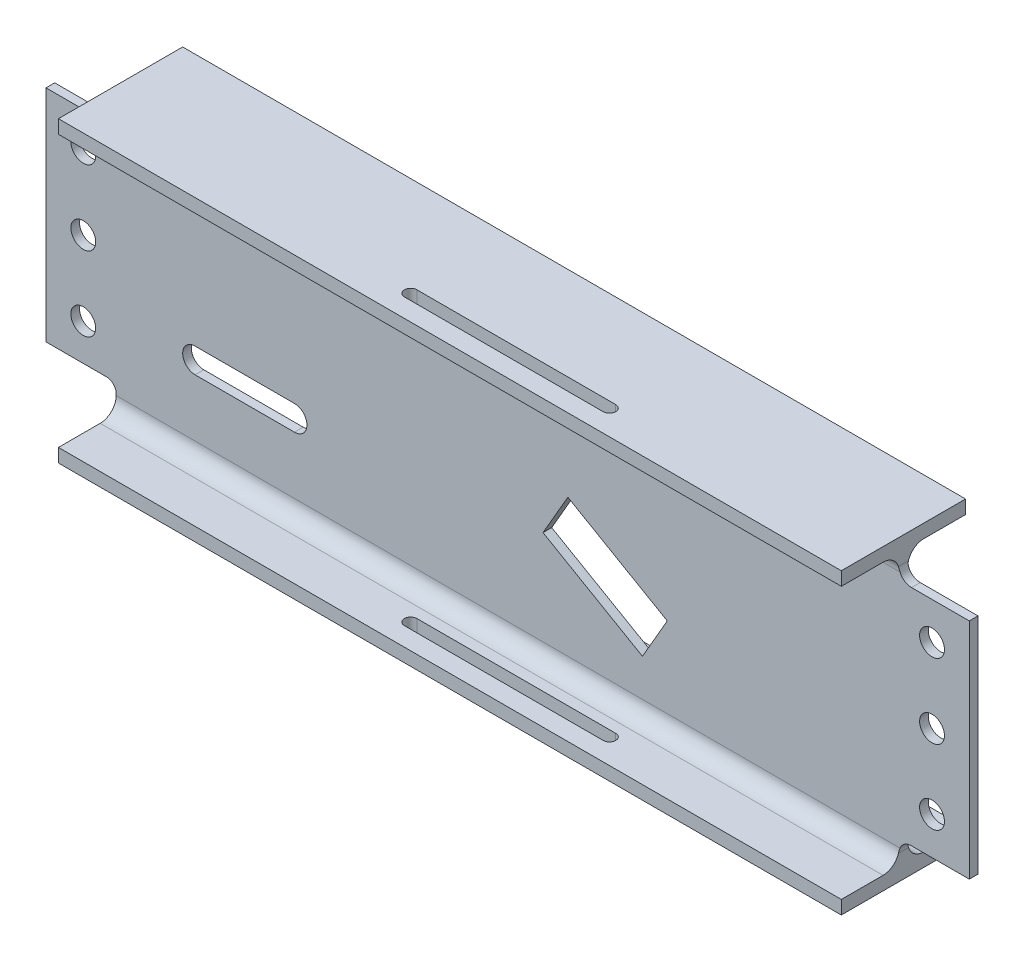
SolidWorks part; units mm, degrees
ref_plane "Front Plane" through (0, 0, 0) normal (0, 0, 1) x (1, 0, 0)
ref_plane "Top Plane" through (0, 0, 0) normal (0, 1, 0) x (1, 0, 0)
ref_plane "Right Plane" through (0, 0, 0) normal (1, 0, 0) x (0, 0, -1)
sketch "Member Sketch" plane through (0, 0, 0) normal (0, 1, 0) x (1, 0, 0)
  line L0 (0, 0) -> (1000, 0)
  line L2 (0, 0) -> (1000, 0) construction
other "Structural Member1"
ref_plane "Plane1" through (0, 0, 0) normal (1, 0, 0) x (0, 0, -1)
sketch "Sketch1" plane through (0, -152.4, 0) normal (1, 0, 0) x (0, 0, -1)
  line L0 (-63.5, 152.4) -> (63.5, 152.4)
  line L1 (63.5, 152.4) -> (63.5, 138.5824)
  line L2 (63.5, 138.5824) -> (20.8534, 138.5824)
  line L3 (4.445, 122.174) -> (4.445, -122.174)
  line L4 (-4.445, 0) -> (4.445, 0) construction
  line L5 (0, -152.4) -> (0, 152.4) construction
  line L6 (-4.445, 122.174) -> (-4.445, -122.174)
  line L7 (-63.5, 138.5824) -> (-20.8534, 138.5824)
  line L8 (-63.5, 152.4) -> (-63.5, 138.5824)
  line L9 (-63.5, -152.4) -> (-63.5, -138.5824)
  line L10 (-63.5, -138.5824) -> (-20.8534, -138.5824)
  line L11 (63.5, -138.5824) -> (20.8534, -138.5824)
  line L12 (63.5, -152.4) -> (63.5, -138.5824)
  line L13 (-63.5, -152.4) -> (63.5, -152.4)
  line L14 (-63.5, 138.5824) -> (-63.5, -138.5824) construction
  line L15 (63.5, 138.5824) -> (63.5, -138.5824) construction
  line L16 (-4.445, 0) -> (-63.5, 0) construction
  line L17 (4.445, 0) -> (63.5, 0) construction
  arc A0 (20.8534, 138.5824) -> (4.445, 122.174) centre (20.8534, 122.174) ccw
  arc A3 (-20.8534, 138.5824) -> (-4.445, 122.174) centre (-20.8534, 122.174) cw
  arc A4 (-20.8534, -138.5824) -> (-4.445, -122.174) centre (-20.8534, -122.174) ccw
  arc A7 (20.8534, -138.5824) -> (4.445, -122.174) centre (20.8534, -122.174) cw
  point P18 (0, 0)
  dimension "Root Radius(r)" = 16.4084
  dimension "Section Depth(D)" = 304.8
  dimension "Flange Width(B)" = 127
  dimension "Flange Thickness(Tf)" = 13.8176
  dimension "Web Thickness(tw)" = 8.89
  dimension "Flange to fillet toe(Kdes)" = 30.226
sketch "Sketch2" plane through (0, 0, 0) normal (0, 1, 0) x (1, 0, 0)
  line L0 (500, 0) -> (1500, 0) construction
  line L1 (0, -69.85) -> (0, 69.85) construction
  line L2 (-167.64, 0) -> (167.64, 0) construction
  text T0 "S12X31.8" font "Century Gothic" height 30
  dimension "D1" = 500
  dimension "D2" = 1000
extrude "MARKING" [suppressed] cut sketch "Sketch2" against normal blind 1
other "0008-AABE004-CN02-FP01D01-1 - MEMBER2 CAVITY"
other "0008-AABE004<1>@0008-AA/0008-AABE004-CN02-FP01<1>@0008-AABE004/0008-AABE004-CN02-FP01D01<1>@0008-AABE004-CN02-FP011"
other "0008-AABE004-CN02-FP01D02-1 - MEMBER2 CAVITY"
other "0008-AABE004<1>@0008-AA/0008-AABE004-CN02-FP01<1>@0008-AABE004/0008-AABE004-CN02-FP01D02<1>@0008-AABE004-CN02-FP011"
other "0008-AABE002-CN01-FP02D01-1 - MEMBER2 CAVITY"
other "0008-AABE002<1>@0008-AA/0008-AABE002-CN01-FP02<1>@0008-AABE002/0008-AABE002-CN01-FP02D01<1>@0008-AABE002-CN01-FP021"
other "0008-AABE002-CN01-FP02D02-1 - MEMBER2 CAVITY"
other "0008-AABE002<1>@0008-AA/0008-AABE002-CN01-FP02<1>@0008-AABE002/0008-AABE002-CN01-FP02D02<1>@0008-AABE002-CN01-FP021"
sketch "Sketch12" plane through (0, 0, -4.445) normal (0, 0, -1) x (-1, 0, 0)
  line L0 (-663.15, -192.4647) -> (-561.55, -133.8059)
  line L1 (-663.15, -192.4647) -> (-637.75, -236.4588)
  line L2 (-561.55, -133.8059) -> (-536.15, -177.8)
  line L3 (-637.75, -236.4588) -> (-536.15, -177.8)
  line L4 (-28.15, -263) -> (-28.15, -38.1) construction
  line L5 (-900.1, -304.8) -> (-99.9, -304.8) construction
  line L6 (-900.1, 0) -> (-99.9, 0) construction
  dimension "D1" = 508
  dimension "D2" = 101.6
  dimension "D3" = 30
  dimension "D4" = 50.8
  dimension "D5" = 177.8
extrude "Cut-Extrude1" cut sketch "Sketch12" against normal through all
sketch "Sketch13" plane through (0, 0, 0) normal (0, 1, 0) x (1, 0, 0)
  line L0 (434.55, -38.1) -> (637.75, -38.1) construction
  line L1 (434.55, -31.75) -> (637.75, -31.75)
  line L2 (434.55, -44.45) -> (637.75, -44.45)
  line L3 (-167.64, 0) -> (167.64, 0) construction
  arc A0 (434.55, -31.75) -> (434.55, -44.45) centre (434.55, -38.1) ccw
  arc A1 (637.75, -44.45) -> (637.75, -31.75) centre (637.75, -38.1) ccw
  point P2 (536.15, -38.1)
  dimension "D1" = 12.7
  dimension "D2" = 203.2
  dimension "D3" = 406.4
  dimension "D4" = 38.1
extrude "Cut-Extrude2" cut sketch "Sketch13" against normal through all
sketch "Sketch120" plane through (0, 0, 4.445) normal (0, 0, 1) x (1, 0, 0)
  line L0 (180.55, -203.2) -> (282.15, -203.2) construction
  line L1 (180.55, -190.5) -> (282.15, -190.5)
  line L2 (180.55, -215.9) -> (282.15, -215.9)
  line L3 (900.1, -304.8) -> (99.9, -304.8) construction
  line L4 (28.15, -263) -> (28.15, -38.1) construction
  arc A0 (180.55, -190.5) -> (180.55, -215.9) centre (180.55, -203.2) ccw
  arc A1 (282.15, -215.9) -> (282.15, -190.5) centre (282.15, -203.2) ccw
  point P2 (231.35, -203.2)
  dimension "D4" = 12.7
  dimension "D1" = 101.6
  dimension "D2" = 101.6
  dimension "D3" = 203.2
extrude "Cut-Extrude3" cut sketch "Sketch120" against normal through all and the other way through all
